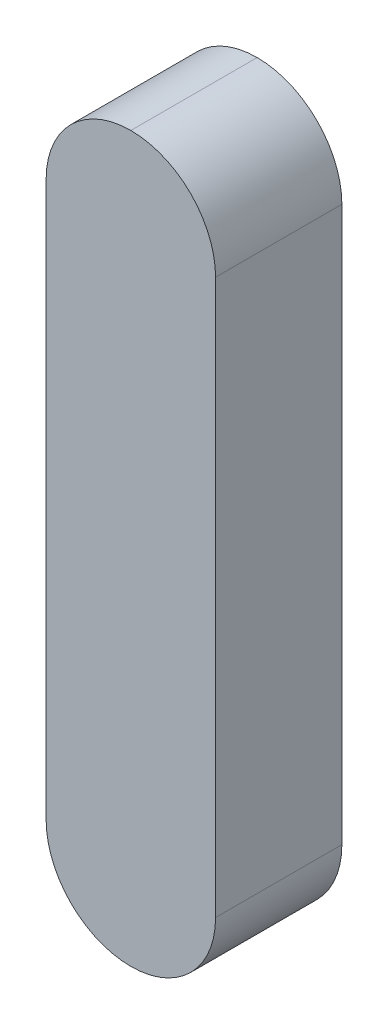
SolidWorks part; units mm, degrees
ref_plane "Plan1" through (0, 0, 0) normal (0, 0, 1) x (1, 0, 0)
ref_plane "Plan2" through (0, 0, 0) normal (0, 1, 0) x (1, 0, 0)
ref_plane "Plan3" through (0, 0, 0) normal (1, 0, 0) x (0, 0, -1)
sketch "Esquisse1" plane through (0, 0, 0) normal (0, 0, 1) x (1, 0, 0)
  line L1 (-47.8, -18.5042) -> (-53.3, -18.5042)
  line L2 (-47.8, -18.5042) -> (-47.8, -42.0042)
  line L3 (-47.8, -42.0042) -> (-53.3, -42.0042)
  line L4 (-53.3, -18.5042) -> (-53.3, -42.0042)
  line L5 (-30.8, -55.7512) -> (-30.8, 55.7512) construction
  line L7 (-41.3, -44.2542) -> (-54.3, -44.2542) construction
  dimension "D1" = 5.5
  dimension "D2" = 23.5
  dimension "D3" = 17
  dimension "D4" = 2.25
extrude "Base-Extrusion" add sketch "Esquisse1" along normal blind 4.1
fillet "Congé1" radius 2.75
